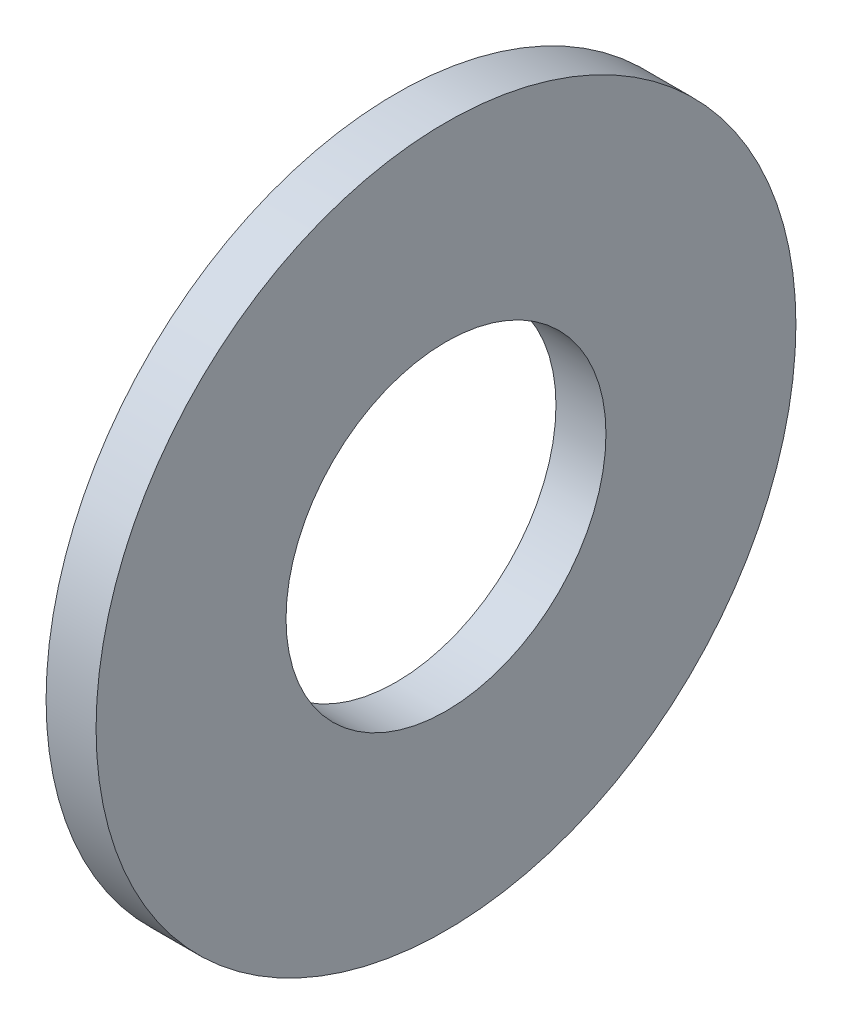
SolidWorks part; units mm, degrees
ref_plane "Plan de face" through (0, 0, 0) normal (0, 0, 1) x (1, 0, 0)
ref_plane "Plan de dessus" through (0, 0, 0) normal (0, 1, 0) x (1, 0, 0)
ref_plane "Plan de droite" through (0, 0, 0) normal (1, 0, 0) x (0, 0, -1)
sketch "Esquisse1" plane through (0, 0, 0) normal (0, 0, 1) x (1, 0, 0)
  line L0 (0, 0) -> (19.5685, 0) construction
  line L1 (6, -5) -> (6, 5) construction
  line L2 (6, 3.2) -> (7, 3.2)
  line L3 (6, 3.2) -> (6, 7)
  line L4 (6, 7) -> (7, 7)
  line L5 (7, 3.2) -> (7, 7)
  line L6 (7, 15) -> (7, -45) construction
  dimension "D1" = 6.4
  dimension "D2" = 14
revolve "Révolution1" add sketch "Esquisse1" angle 360 about L0
